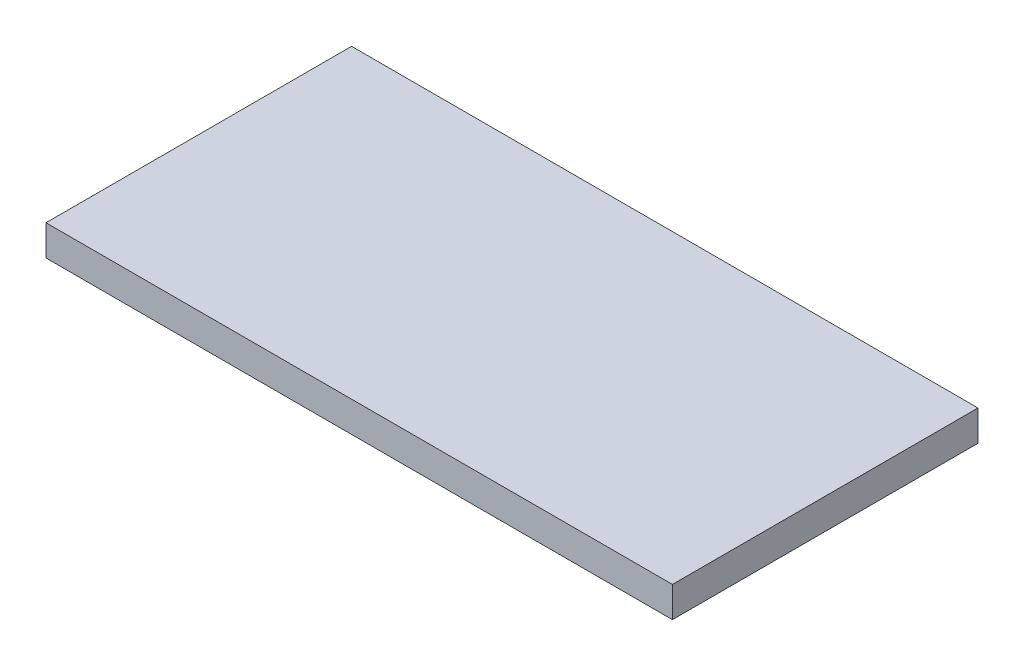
SolidWorks part; units mm, degrees
ref_plane "Front Plane" through (0, 0, 0) normal (0, 0, 1) x (1, 0, 0)
ref_plane "Top Plane" through (0, 0, 0) normal (0, 1, 0) x (1, 0, 0)
ref_plane "Right Plane" through (0, 0, 0) normal (1, 0, 0) x (0, 0, -1)
sketch "Skizze1" plane through (0, 0, 0) normal (0, 0, 1) x (1, 0, 0)
  line L1 (-45, 0) -> (160, 0)
  line L2 (-45, 0) -> (-45, 10)
  line L3 (-45, 10) -> (160, 10)
  line L4 (160, 0) -> (160, 10)
extrude "Aufsatz-Linear austragen1" add sketch "Skizze1" along normal mid plane 100
